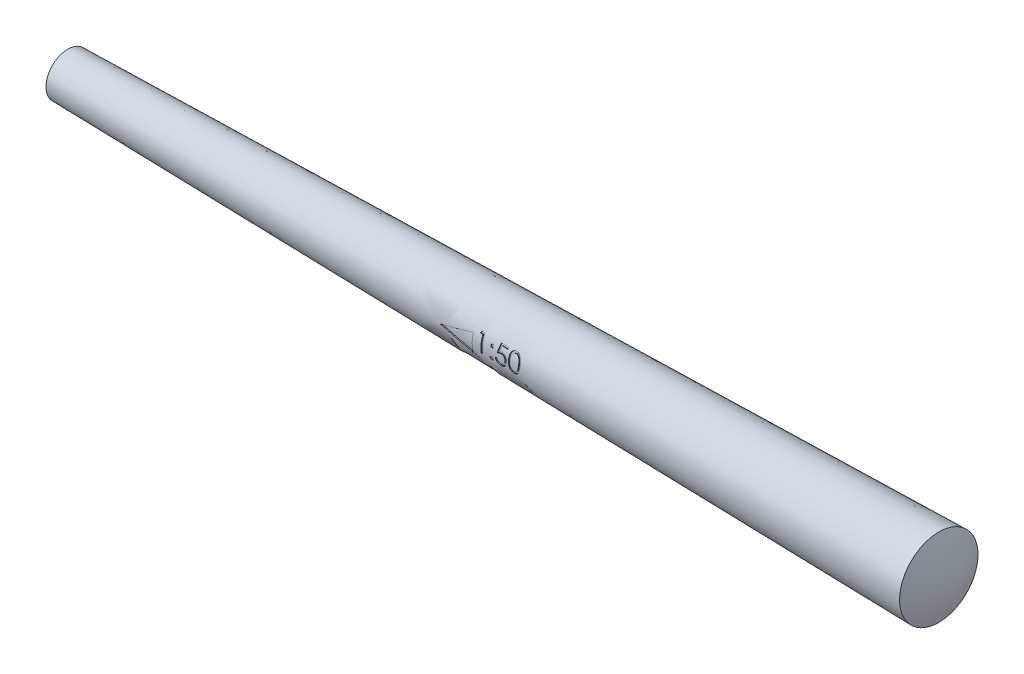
SolidWorks part; units mm, degrees
ref_plane "Front Plane" through (0, 0, 0) normal (0, 0, 1) x (1, 0, 0)
ref_plane "Top Plane" through (0, 0, 0) normal (0, 1, 0) x (1, 0, 0)
ref_plane "Right Plane" through (0, 0, 0) normal (1, 0, 0) x (0, 0, -1)
sketch "Sketch1" plane through (0, 0, 0) normal (1, 0, 0) x (0, 0, -1)
  circle A0 centre (0, 0) radius 1.25
  dimension "D1" = 2.5
extrude "Extrude1" add sketch "Sketch1" along normal mid plane 50
draft "Draft1" type of draft neutral plane draft angle 1.146 faces to draft 1 parameters "D1"=1.146
sketch "Sketch2" plane through (0, 0, 0) normal (0, 0, 1) x (1, 0, 0)
  line L0 (-25, 0) -> (-25, 1.25)
  line L1 (-25, 1.25) -> (-25, -1.25) construction
  line L2 (-25, 0) -> (-25.4, 0)
  line L3 (-25.4, 0) -> (-25.4, -1.75) construction
  line L4 (25, 0) -> (25, 2.25)
  line L5 (25, -2.25) -> (25, 2.25) construction
  line L6 (25, 0) -> (25.4, 0)
  line L7 (25.4, 0) -> (25.4, -1.75) construction
  line L8 (-25, -1.25) -> (25, -2.25) construction
  arc A0 (-25.4, 0) -> (-25, 1.25) centre (-23.2469, 0) cw
  arc A1 (25.4, 0) -> (25, 2.25) centre (18.8717, 0) ccw
  point P14 (0, -1.75)
revolve "Revolve1" add sketch "Sketch2" angle 360 about L2
sketch "Sketch5" plane through (0, 0, 0) normal (0, 0, 1) x (1, 0, 0)
  line L0 (0, 1.75) -> (0, -1.75) construction
  line L1 (25, 2.25) -> (-25, 1.25) construction
  line L2 (-25, -1.25) -> (25, -2.25) construction
ref_plane "Plane2" through (0, 0, 0) normal (-0.02, 0, 0.9998) x (0.9998, 0, 0.02)
sketch "Sketch6" plane through (0, 0, 0) normal (-0.02, 0, 0.9998) x (0.9998, 0, 0.02)
  line L0 (0, 0) -> (0, 0.5)
  line L1 (0, 1.75) -> (0, -1.75) construction
  line L2 (0, 0.5) -> (-1.866, 0)
  line L3 (-1.866, 0) -> (0, -0.5)
  line L4 (0, -0.5) -> (0, 0)
  line L5 (0, -0.25) -> (3, -0.25) construction
  text T0 "1:50" font "Century Gothic" height 1
  dimension "D1" = 1
  dimension "D2" = 30
  dimension "D3" = 3
wrap "Wrap2" sketch "Sketch6" wrap type deboss source sketch "Sketch6" thickness 0.05 parameters "D1"=0.05
equation "\"D2@Sketch2\" = \"D1@Sketch2\""
